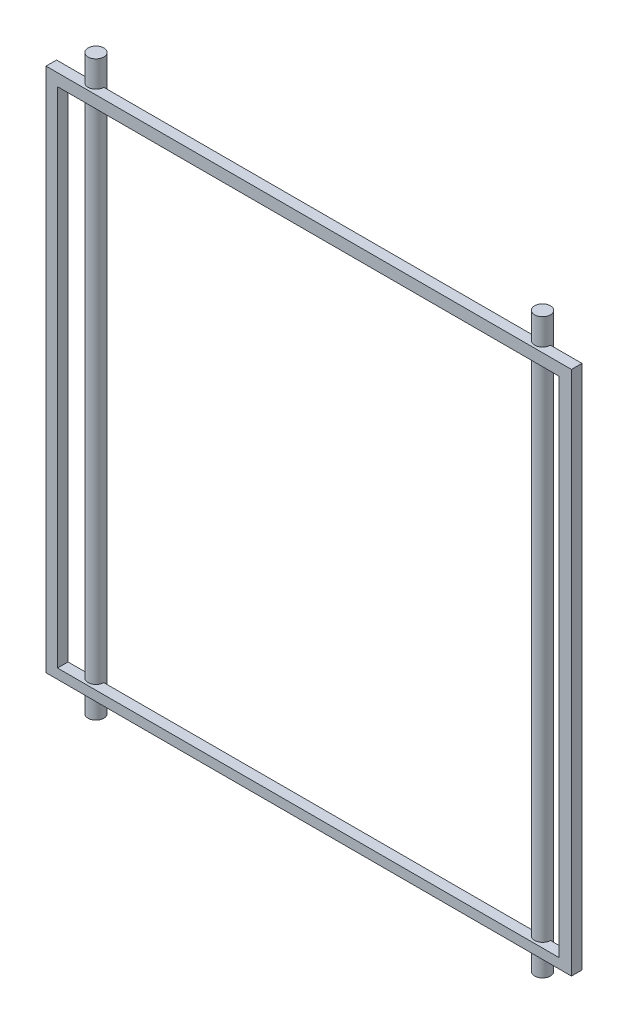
SolidWorks part; units mm, degrees
ref_plane "Piano frontale" through (0, 0, 0) normal (0, 0, 1) x (1, 0, 0)
ref_plane "Piano superiore" through (0, 0, 0) normal (0, 1, 0) x (1, 0, 0)
ref_plane "Piano destro" through (0, 0, 0) normal (1, 0, 0) x (0, 0, -1)
sketch "Schizzo1" plane through (0, 0, 0) normal (0, 0, 1) x (1, 0, 0)
  line L1 (-75, 920) -> (925, 920)
  line L2 (-75, 920) -> (-75, -80)
  line L3 (-75, -80) -> (925, -80)
  line L4 (925, 920) -> (925, -80)
  line L5 (-53.163, 897.0169) -> (901.1776, 897.0169)
  line L6 (-53.163, 897.0169) -> (-53.163, -61.2429)
  line L7 (-53.163, -61.2429) -> (901.1776, -61.2429)
  line L8 (901.1776, 897.0169) -> (901.1776, -61.2429)
extrude "Estrusione1" add sketch "Schizzo1" along normal blind 20
sketch "Schizzo2" plane through (0, 0, 0) normal (0, 1, 0) x (1, 0, 0)
  circle A0 centre (850, 0) radius 15
  circle A1 centre (0, 0) radius 15
extrude "Estrusione2" add sketch "Schizzo2" along normal blind 970 and the other way blind 120
